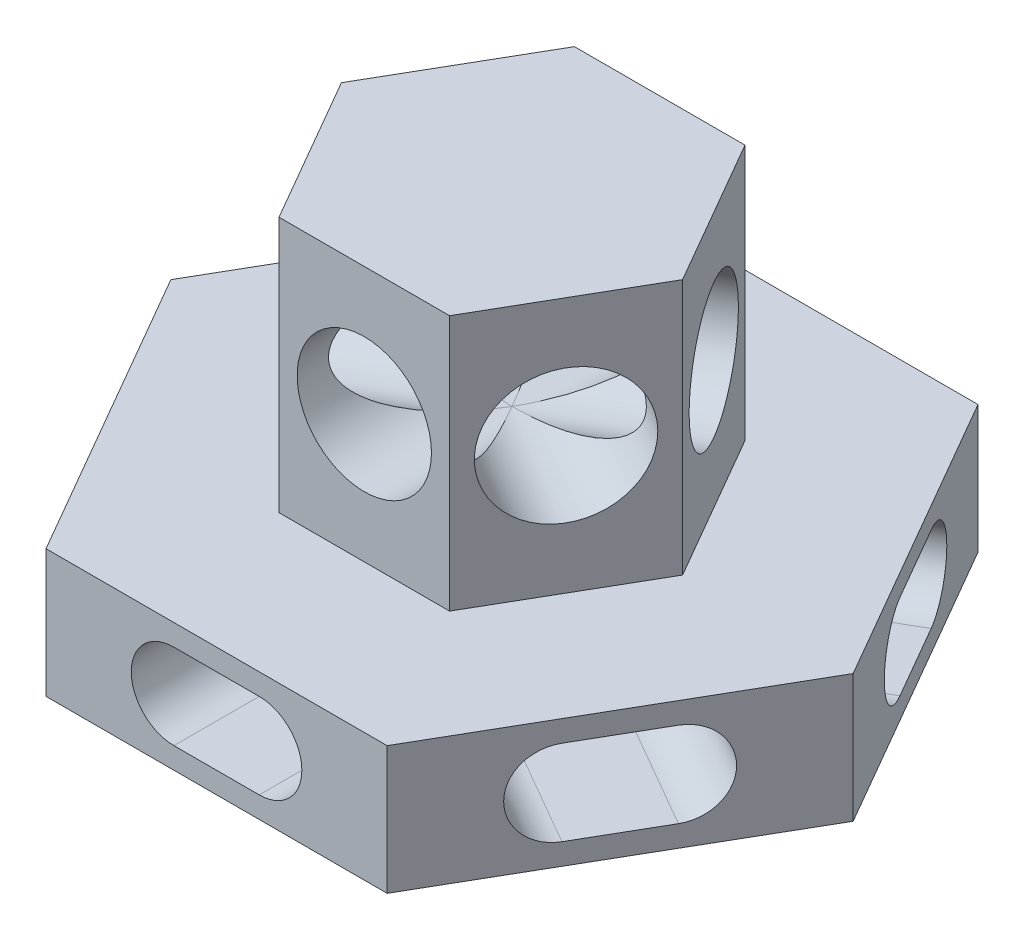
SolidWorks part; units mm, degrees
ref_plane "Alzado" through (0, 0, 0) normal (0, 0, 1) x (1, 0, 0)
ref_plane "Planta" through (0, 0, 0) normal (0, 1, 0) x (1, 0, 0)
ref_plane "Vista lateral" through (0, 0, 0) normal (1, 0, 0) x (0, 0, -1)
sketch "Croquis1" plane through (0, 0, 0) normal (0, 1, 0) x (1, 0, 0)
  line L1 (40, 69.282) -> (-40, 69.282)
  line L2 (-40, 69.282) -> (-80, 0)
  line L3 (-80, 0) -> (-40, -69.282)
  line L4 (-40, -69.282) -> (40, -69.282)
  line L5 (40, -69.282) -> (80, 0)
  line L6 (80, 0) -> (40, 69.282)
  circle A0 centre (0, 0) radius 69.282 construction
  dimension "D1" = 80
sketch "Croquis2" plane through (0, 0, 0) normal (0, 1, 0) x (1, 0, 0)
  line L7 (20, 34.641) -> (-20, 34.641)
  line L8 (-20, 34.641) -> (-40, 0)
  line L9 (-40, 0) -> (-20, -34.641)
  line L10 (-20, -34.641) -> (20, -34.641)
  line L11 (20, -34.641) -> (40, 0)
  line L12 (40, 0) -> (20, 34.641)
  circle A1 centre (0, 0) radius 34.641 construction
  dimension "D1" = 40
extrude "Saliente-Extruir1" add sketch "Croquis1" along normal blind 30
extrude "Saliente-Extruir2" add sketch "Croquis2" along normal blind 90
sketch "Croquis3" plane through (60, 0, 34.641) normal (0.866, 0, 0.5) x (0.5, 0, -0.866)
  line L0 (-10, 15) -> (10, 15) construction
  line L1 (-10, 25) -> (10, 25)
  line L2 (-10, 5) -> (10, 5)
  line L3 (-40, 0) -> (40, 0) construction
  arc A0 (-10, 25) -> (-10, 5) centre (-10, 15) ccw
  arc A1 (10, 5) -> (10, 25) centre (10, 15) ccw
  point P2 (0, 15)
  dimension "D1" = 10
  dimension "D2" = 20
  dimension "D3" = 5
extrude "Cortar-Extruir1" cut sketch "Croquis3" against normal up to next
pattern_circular "MatrizC1" count 6 over 360 about axis through (0, 0, 0) along (0, 1, 0) of "Cortar-Extruir1"
sketch "Croquis4" plane through (30, 0, -17.3205) normal (0.866, 0, -0.5) x (-0.5, 0, -0.866)
  line L0 (-40, 30) -> (40, 30) construction
  circle A0 centre (0, 60) radius 15.75
  dimension "D1" = 31.5
  dimension "D2" = 30
extrude "Cortar-Extruir2" cut sketch "Croquis4" against normal up to next
pattern_circular "MatrizC2" count 6 over 360 about axis through (0, 90, 0) along (0, 1, 0) of "Cortar-Extruir2"
